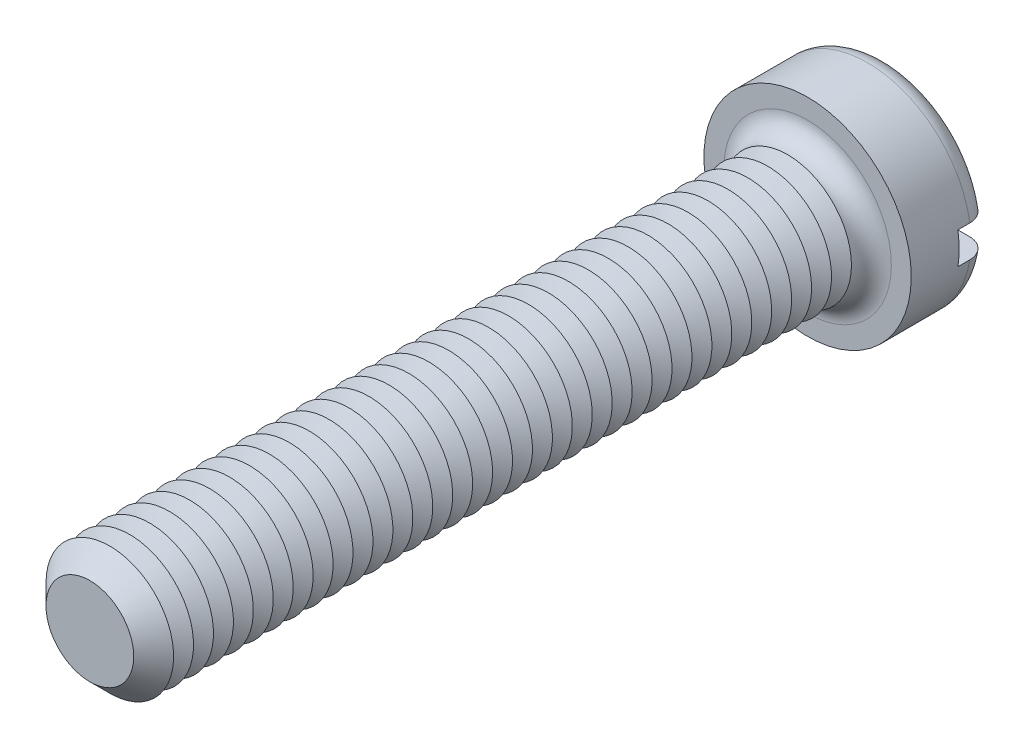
SolidWorks part; units mm, degrees
ref_plane "Front Plane" through (0, 0, 0) normal (0, 0, 1) x (1, 0, 0)
ref_plane "Top Plane" through (0, 0, 0) normal (0, 1, 0) x (1, 0, 0)
ref_plane "Right Plane" through (0, 0, 0) normal (1, 0, 0) x (0, 0, -1)
sketch "Sketch3" plane through (0, 0, 0) normal (0, 0, 1) x (1, 0, 0)
  circle A0 centre (0, 0) radius 6.5
  dimension "D1" = 13
extrude "Boss-Extrude2" add sketch "Sketch3" against normal blind 5
sketch "Sketch4" plane through (0, 0, 0) normal (0, 0, 1) x (1, 0, 0)
  circle A0 centre (0, 0) radius 4
  dimension "D1" = 8
extrude "Boss-Extrude3" add sketch "Sketch4" along normal blind 45
fillet "Fillet1" radius 1.25 2 edges at (6.5, 0, -5) (4, 0, 0)
chamfer "Chamfer1" distance 1.25 angle 45 1 edges at (4, 0, 45)
sketch "Sketch5" plane through (0, 0, 0) normal (1, 0, 0) x (0, 0, -1)
  line L0 (1.6944, 0) -> (-7.6738, 0) construction
sketch "Sketch6" plane through (0, 0, 0) normal (1, 0, 0) x (0, 0, -1)
  line L0 (-1.25, 4) -> (-1.875, 2.9175)
  line L1 (-1.875, 2.9175) -> (-2.5, 4)
  line L2 (-1.25, 4) -> (-43.75, 4) construction
  line L3 (-2.5, 4) -> (-1.25, 4)
  dimension "D1" = 1.25
revolve "Cut-Revolve1" cut sketch "Sketch6" angle 360 about L0
pattern_linear "LPattern1" count 34 spacing 1.25 along (0, 0, 1) of "Cut-Revolve1"
sketch "Sketch8" plane through (0, 0, -5) normal (0, 0, -1) x (-1, 0, 0)
  line L1 (6.5, -1) -> (-6.5, -1)
  line L2 (6.5, -1) -> (6.5, 1)
  line L3 (6.5, 1) -> (-6.5, 1)
  line L4 (-6.5, -1) -> (-6.5, 1)
  line L5 (6.5, -1) -> (-6.5, 1) construction
  line L6 (6.5, 1) -> (-6.5, -1) construction
  point P0 (0, 0)
  dimension "D1" = 13
  dimension "D2" = 2
extrude "Cut-Extrude1" cut sketch "Sketch8" against normal blind 2
